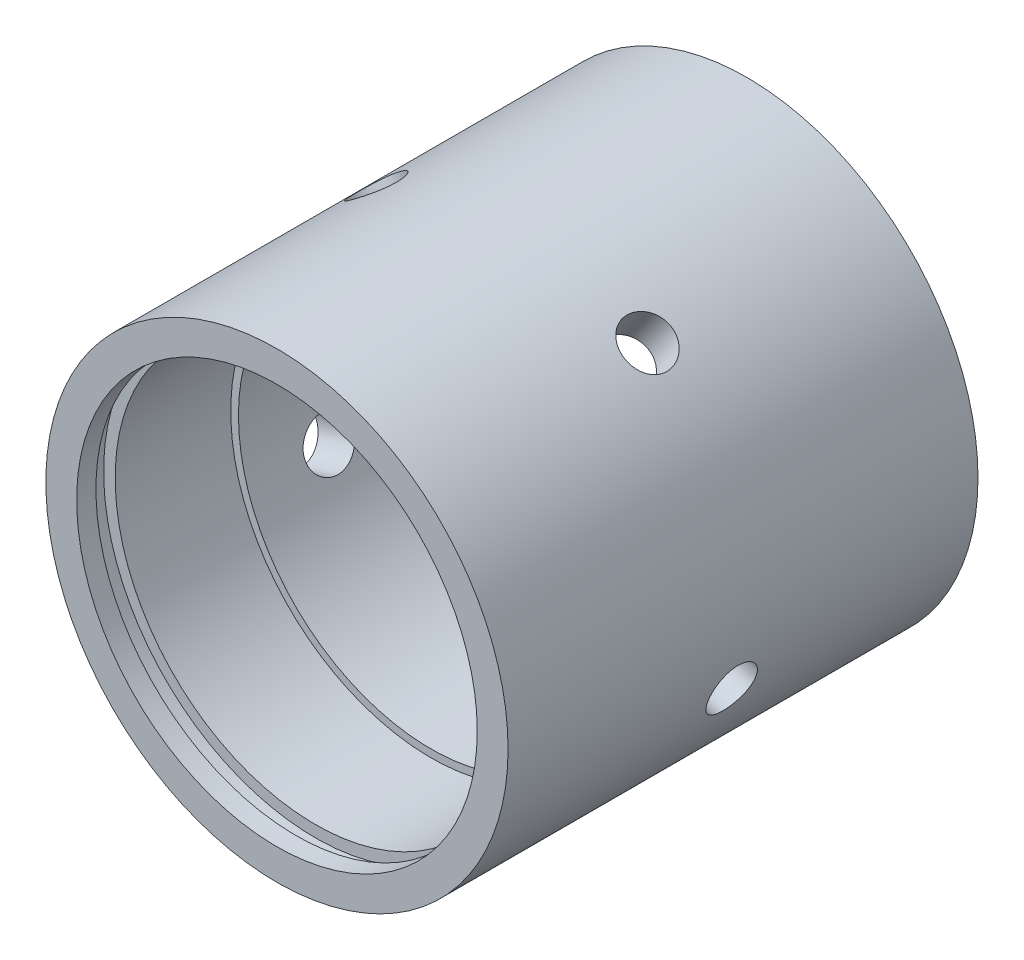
SolidWorks part; units mm, degrees
ref_plane "Alzado" through (0, 0, 0) normal (0, 0, 1) x (1, 0, 0)
ref_plane "Planta" through (0, 0, 0) normal (0, 1, 0) x (1, 0, 0)
ref_plane "Vista lateral" through (0, 0, 0) normal (1, 0, 0) x (0, 0, -1)
sketch "Sketch1" plane through (0, 0, 0) normal (0, 0, 1) x (1, 0, 0)
  circle A0 centre (0, 0) radius 30
  circle A1 centre (0, 0) radius 25
extrude "Extrude1" add sketch "Sketch1" along normal mid plane 57
sketch "Sketch2" plane through (0, 0, 28.5) normal (0, 0, 1) x (1, 0, 0)
  circle A0 centre (0, 0) radius 26
  circle A1 centre (0, 0) radius 12.2448
extrude "Cut-Extrude1" cut sketch "Sketch2" against normal blind 18
mirror "Mirror1" about plane through (0, 0, 0) normal (0, 0, 1) of "Cut-Extrude1"
ref_plane "Plano1" through (0, 0, 25.5) normal (0, 0, 1) x (1, 0, 0)
sketch "Croquis1" plane through (0, 0, 25.5) normal (0, 0, 1) x (1, 0, 0)
  circle A0 centre (0, 0) radius 27.5
  circle A1 centre (0, 0) radius 12.0047
extrude "Cortar-Extruir1" cut sketch "Croquis1" along normal blind 2.5
sketch "Croquis2" plane through (0, 0, 28.5) normal (0, 0, 1) x (1, 0, 0)
  circle A0 centre (0, 0) radius 26 construction
  circle A1 centre (0, 0) radius 30 construction
  circle A2 centre (0, 0) radius 26
  circle A3 centre (0, 0) radius 30
extrude "Extruir1" add sketch "Croquis2" along normal blind 2
mirror "Simetría1" about plane through (0, 0, 0) normal (0, 0, 1) of "Extruir1", "Cortar-Extruir1"
sketch "Croquis3" plane through (0, 0, 0) normal (0, 1, 0) x (1, 0, 0)
  circle A0 centre (0, 0) radius 3.2
extrude "Cortar-Extruir2" cut sketch "Croquis3" against normal up to next
sketch "Croquis4" plane through (0, 0, 0) normal (0, 1, 0) x (1, 0, 0)
  line L0 (0, 34.2332) -> (0, 0)
ref_axis "Eje1" through (0, 0, 0) along (0, 0, -1)
pattern_circular "MatrizC1" count 5 over 360 about axis through (0, 0, 0) along (0, 0, -1) of "Cortar-Extruir2"
